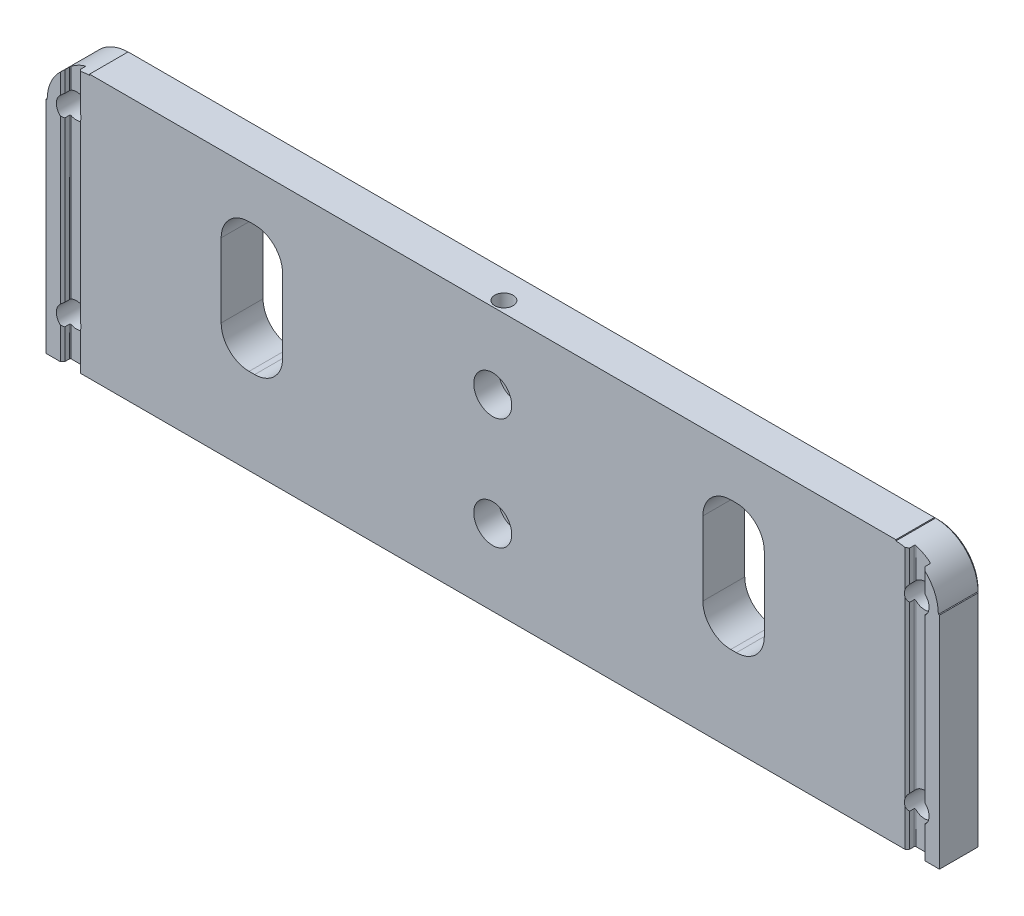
SolidWorks part; units mm, degrees
ref_plane "Front Plane" through (0, 0, 0) normal (0, 0, 1) x (1, 0, 0)
ref_plane "Top Plane" through (0, 0, 0) normal (0, 1, 0) x (1, 0, 0)
ref_plane "Right Plane" through (0, 0, 0) normal (1, 0, 0) x (0, 0, -1)
imported_body "Imported1"
other "Move Face1" parameters "D1"=2.794
